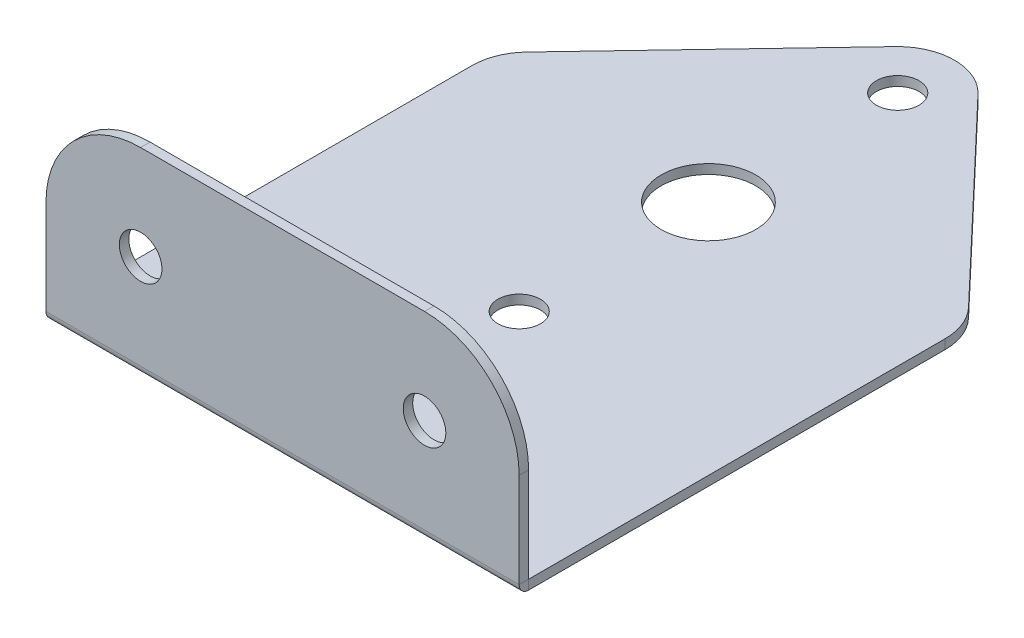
SolidWorks part; units mm, degrees
ref_plane "Front" through (0, 0, 0) normal (0, 0, 1) x (1, 0, 0)
ref_plane "Top" through (0, 0, 0) normal (0, 1, 0) x (1, 0, 0)
ref_plane "Right" through (0, 0, 0) normal (1, 0, 0) x (0, 0, -1)
sketch "Sketch1" plane through (0, 0, 0) normal (0, 1, 0) x (1, 0, 0)
  line L1 (0, 0) -> (50, 0)
  line L2 (0, 0) -> (0, 66)
  line L4 (50, 0) -> (50, 66)
  line L9 (1.65, 70.1325) -> (20.65, 90.1325)
  line L10 (48.35, 70.1325) -> (29.35, 90.1325)
  circle A0 centre (10, 10) radius 2.25
  circle A1 centre (40, 10) radius 2.25
  circle A2 centre (25, 86) radius 2.25
  arc A3 (29.35, 90.1325) -> (20.65, 90.1325) centre (25, 86) ccw
  circle A4 centre (25, 66) radius 5
  circle A5 centre (25, 46) radius 2.25
  arc A6 (1.65, 70.1325) -> (0, 66) centre (6, 66) ccw
  arc A7 (50, 66) -> (48.35, 70.1325) centre (44, 66) ccw
sheet metal parameters "Sheet-Metal1" thickness 1 parameters "D1"=0
base flange "Base-Flange1" sketch "Sketch1" thickness 1 reverse thickness direction yes parameters "D1"=0
sketch "Sketch3" plane through (0, 1, 0) normal (0, 1, 0) x (-1, 0, 0)
  line L1 (0, -21) -> (-50, -21)
sketched bend "Sketched Bend1" parameters "D1"=0
bend "SketchBend1" bend radius 0 bend angle 90 parameters "D5"=1
fillet "Fillet1" radius 10 1 edges at (50, 21.005, -21.495)
fillet "Fillet2" radius 10 1 edges at (0, 21.005, -21.495)
flat pattern "Flat-Pattern1"
sketch "Bend-Lines1" plane through (0, 1, 0) normal (0, 1, 0) x (-1, 0, 0)
  line L0 (-50, -21) -> (0, -21) construction
bend of the flat pattern "Flatten-<SketchBend1>1"
